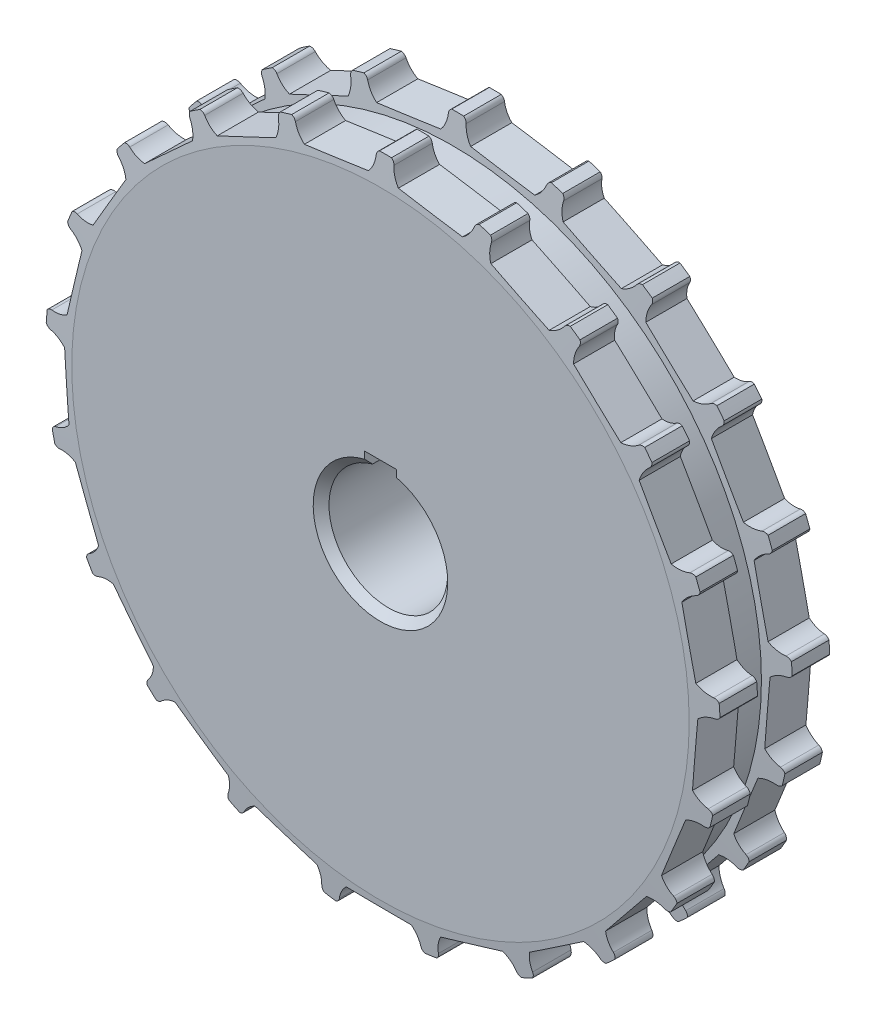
SolidWorks part; units mm, degrees
ref_plane "Alzado" through (0, 0, 0) normal (0, 0, 1) x (1, 0, 0)
ref_plane "Planta" through (0, 0, 0) normal (0, 1, 0) x (1, 0, 0)
ref_plane "Vista lateral" through (0, 0, 0) normal (1, 0, 0) x (0, 0, -1)
sketch "Croquis1" plane through (0, 0, 0) normal (0, 0, 1) x (1, 0, 0)
  circle A0 centre (0, 0) radius 85.25
  circle A1 centre (0, 0) radius 15
  dimension "D1" = 170.5
  dimension "D2" = 30
extrude "Extruir1" add sketch "Croquis1" along normal mid plane 29
sketch "Croquis2" plane through (0, 0, 0) normal (0, 0, 1) x (1, 0, 0)
  circle A0 centre (0, 0) radius 85.25 construction
  circle A1 centre (0, 0) radius 85.25
  circle A2 centre (0, 0) radius 78
  dimension "D1" = 156
extrude "Cortar-Extruir1" cut sketch "Croquis2" against normal mid plane 7.5
chamfer "Chaflán1" distance 2 angle 45 2 edges at (15, 0, -14.5) (15, 0, 14.5)
chamfer "Chaflán2" distance 7.25 angle 5 2 edges at (85.25, 0, 3.75) (85.25, 0, -14.5)
chamfer "Chaflán3" distance 7.25 angle 5 2 edges at (85.25, 0, -3.75) (85.25, 0, 14.5)
sketch "Croquis3" plane through (0, 0, 0) normal (0, 0, 1) x (1, 0, 0)
  line L0 (0, 0) -> (0, 88.3104) construction
  line L1 (0, 0) -> (25.964, 84.1733) construction
  line L2 (0, 0) -> (51.1995, 75.0959) construction
  line L3 (0, 0) -> (70.8056, 56.4656) construction
  line L4 (0, 0) -> (89.3387, 35.0629) construction
  line L5 (0, 0) -> (90.9763, 6.8177) construction
  line L6 (0, 0) -> (96.6374, -22.0569) construction
  line L7 (0, 0) -> (79.4662, -45.8799) construction
  line L8 (0, 0) -> (69.9769, -75.4172) construction
  line L9 (0, 0) -> (42.2237, -87.6784) construction
  line L10 (0, 0) -> (13.5666, -90.0083) construction
  line L11 (0, 0) -> (-13.8992, -92.215) construction
  line L12 (0, 0) -> (-42.0575, -87.3333) construction
  line L13 (0, 0) -> (-64.6149, -69.6383) construction
  line L14 (0, 0) -> (-85.1943, -49.1869) construction
  line L15 (0, 0) -> (-90.8337, -20.7322) construction
  line L16 (0, 0) -> (-96.1372, 7.2045) construction
  line L17 (0, 0) -> (-88.1434, 34.5937) construction
  line L18 (0, 0) -> (-69.9567, 55.7886) construction
  line L19 (0, 0) -> (-52.7361, 77.3497) construction
  line L20 (0, 0) -> (-28.1707, 91.3272) construction
  dimension "D1" = 17.143
  dimension "D2" = 17.143
  dimension "D3" = 17.143
  dimension "D4" = 17.143
  dimension "D5" = 17.143
  dimension "D6" = 17.143
  dimension "D7" = 17.143
  dimension "D8" = 17.143
  dimension "D9" = 17.143
  dimension "D10" = 17.143
  dimension "D11" = 17.143
  dimension "D12" = 17.143
  dimension "D13" = 17.143
  dimension "D14" = 17.143
  dimension "D15" = 17.143
  dimension "D16" = 17.143
  dimension "D17" = 17.143
  dimension "D18" = 17.143
  dimension "D19" = 17.143
  dimension "D20" = 17.143
  dimension "D21" = 17.143
sketch "Croquis5" plane through (0, 0, 0) normal (0, 0, 1) x (1, 0, 0)
  line L0 (24.3442, 81.7235) -> (28.251, 82.483)
  line L1 (7.1439, 75.8346) -> (-12.5, 75.8346) construction
  line L2 (32.2251, 107.5746) -> (28.251, 82.483)
  line L3 (4.3529, 79.9015) -> (20.551, 77.336)
  line L4 (2.1013, 85.2465) -> (-1.3797, 87.176)
  line L5 (7.1439, 75.8346) -> (-12.5, 75.8346) construction
  line L6 (2.5945, 112.2676) -> (-1.3797, 87.176)
  line L8 (2.5945, 112.2676) -> (32.2251, 107.5746)
  line L9 (0, 0) -> (17.4098, 109.9211) construction
  circle A0 centre (0, 0) radius 83.75 construction
  arc A1 (23.2196, 80.7607) -> (20.551, 77.336) centre (16.636, 83.1388) cw
  arc A2 (2.8732, 83.9832) -> (4.3529, 79.9015) centre (9.8696, 84.2105) ccw
  arc A3 (24.3442, 81.7235) -> (23.2196, 80.7607) centre (24.6304, 80.2511) ccw
  arc A4 (4.4, 80.2889) -> (5.8443, 76.0305) centre (11.4, 80.2889) ccw construction
  circle A5 centre (0, 0) radius 84.5 construction
  arc A6 (4.4, 80.2889) -> (6, 75.8346) centre (11.4, 80.2889) ccw construction
  circle A7 centre (0, 0) radius 78
  arc A8 (-4.2401, 77.8847) -> (8.1791, 77.57) centre (0, 0) ccw construction
  arc A9 (2.1013, 85.2465) -> (2.8732, 83.9832) centre (1.374, 83.9346) cw
  circle A10 centre (0, 0) radius 80.02 construction
  circle A11 centre (0, 0) radius 85.25 construction
  arc A13 (13.336, 84.2004) -> (24.2983, 81.7139) centre (0, 0) ccw construction
  point P22 (12.452, 78.6188)
  point P42 (13.9148, 74.3531)
  point P43 (13.8499, 74.3652)
  dimension "D3" = 1.5
  dimension "D6" = 0
  dimension "D7" = 16.4
  dimension "D5" = 167.5
  dimension "D11" = 4.9269
  dimension "D12" = 6.2881
  dimension "D1" = 15
  dimension "D2" = 7
  dimension "D9" = 3.8
  dimension "D10" = 20
  dimension "D4" = 169
  dimension "D13" = 22.5202
  dimension "D8" = 20.6
  dimension "D14" = 5.6513
  dimension "D15" = 160.04
extrude "Cortar-Extruir2" cut sketch "Croquis5" against normal through all and the other way through all
pattern_circular "MatrizC1" count 21 over 360 about axis through (0, 0, 0) along (0, 0, 1) of "Cortar-Extruir2"
sketch "Croquis7" plane through (0, 0, 0) normal (0, 0, 1) x (1, 0, 0)
  circle A0 centre (0, 0) radius 85.2 construction
  dimension "D1" = 170.4
sketch "Croquis8" plane through (0, 0, 0) normal (0, 0, 1) x (1, 0, 0)
  line L0 (0, -15) -> (0, 18.3) construction
  line L1 (-4, 18.3) -> (4, 18.3)
  line L2 (-4, 18.3) -> (-4, 13.3)
  line L3 (4, 18.3) -> (4, 13.3)
  line L4 (-4, 13.3) -> (4, 13.3)
  circle A0 centre (0, 0) radius 15 construction
  point P8 (0, 18.3)
  dimension "D1" = 33.3
  dimension "D2" = 8
  dimension "D3" = 5
extrude "Cortar-Extruir3" cut sketch "Croquis8" against normal through all both and the other way through all
